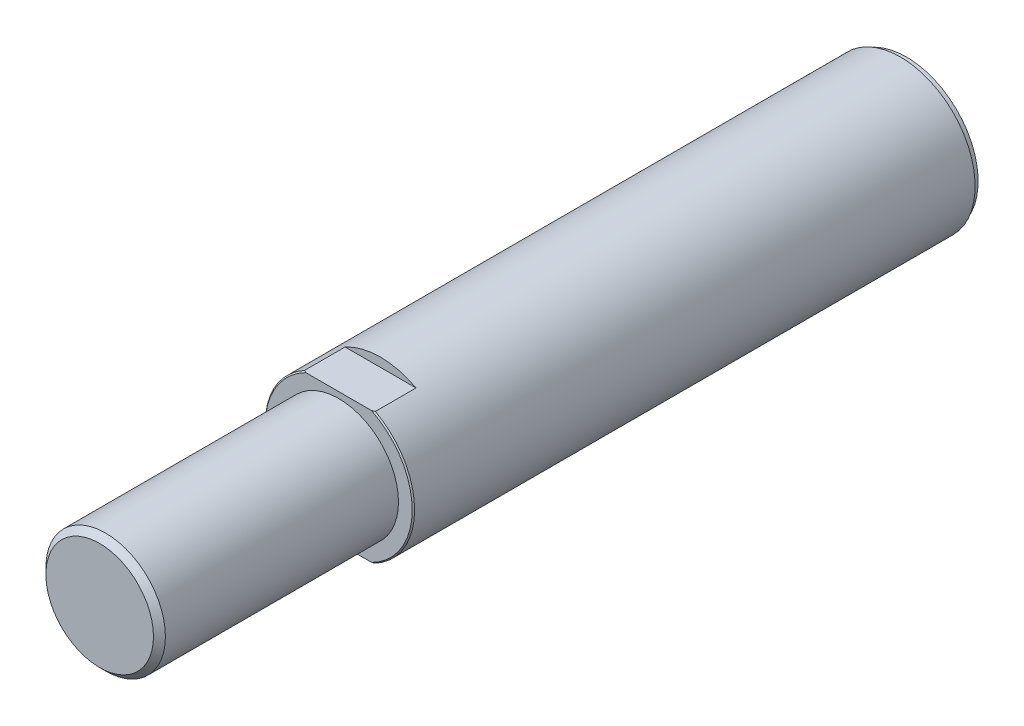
SolidWorks part; units mm, degrees
ref_plane "Plano frontal" through (0, 0, 0) normal (0, 0, 1) x (1, 0, 0)
ref_plane "Plano superior" through (0, 0, 0) normal (0, 1, 0) x (1, 0, 0)
ref_plane "Plano direito" through (0, 0, 0) normal (1, 0, 0) x (0, 0, -1)
sketch "Esboço1" plane through (0, 0, 0) normal (0, 0, 1) x (1, 0, 0)
  circle A0 centre (0, 0) radius 12.5
  dimension "D1" = 25
extrude "Ressalto-extrusão1" add sketch "Esboço1" along normal blind 135
sketch "Esboço2" plane through (0, 0, 135) normal (0, 0, 1) x (1, 0, 0)
  circle A0 centre (0, 0) radius 10
  dimension "D1" = 20
extrude "Corte-extrusão1" cut sketch "Esboço2" against normal blind 40 flip side to cut
hole_wizard "Furo roscado de M12x1.751" positions "Esboço3" profile "Esboço4" tap size "M12x1.75" standard "Ansi Metric"
sketch "Esboço3" plane through (0, 0, 0) normal (0, 0, -1) x (-1, 0, 0)
  point P0 (0, 0)
sketch "Esboço4" plane through (0, 0, 0) normal (1, 0, 0) x (0, 1, 0)
  line L0 (0, 0) -> (0, 35.8144)
  line L1 (0, 35.8144) -> (5.1, 32.75)
  line L2 (5.1, 32.75) -> (5.1, 0)
  line L5 (5.1, 0) -> (0, 0)
  line L10 (0, 35.8144) -> (-5.1, 32.75) construction
  line L11 (0, -6.35) -> (0, 107.95) construction
  dimension "Tap Drill Dia." = 10.2
  dimension "Tap Drill Depth" = 32.75
  dimension "Drill Angle" = 118
sketch "Esboço5" plane through (0, 0, 0) normal (0, 0, -1) x (-1, 0, 0)
  circle A0 centre (0, 0) radius 12
  dimension "D1" = 24
extrude "Corte-extrusão2" cut sketch "Esboço5" against normal blind 1 flip side to cut
chamfer "Chanfro1" distance 0.2 angle 45 1 edges at (12.5, 0, 95)
chamfer "Chanfro2" distance 1 angle 45 1 edges at (10, 0, 135)
sketch "Esboço6" plane through (0, 0, 95) normal (0, 0, 1) x (1, 0, 0)
  line L1 (-21.0914, -11) -> (21.0914, -11)
  line L2 (-21.0914, -11) -> (-21.0914, 11)
  line L3 (-21.0914, 11) -> (21.0914, 11)
  line L4 (21.0914, -11) -> (21.0914, 11)
  line L5 (-21.0914, -11) -> (21.0914, 11) construction
  line L6 (-21.0914, 11) -> (21.0914, -11) construction
  point P0 (0, 0)
  dimension "D1" = 22
extrude "Corte-extrusão3" cut sketch "Esboço6" against normal blind 7 flip side to cut
